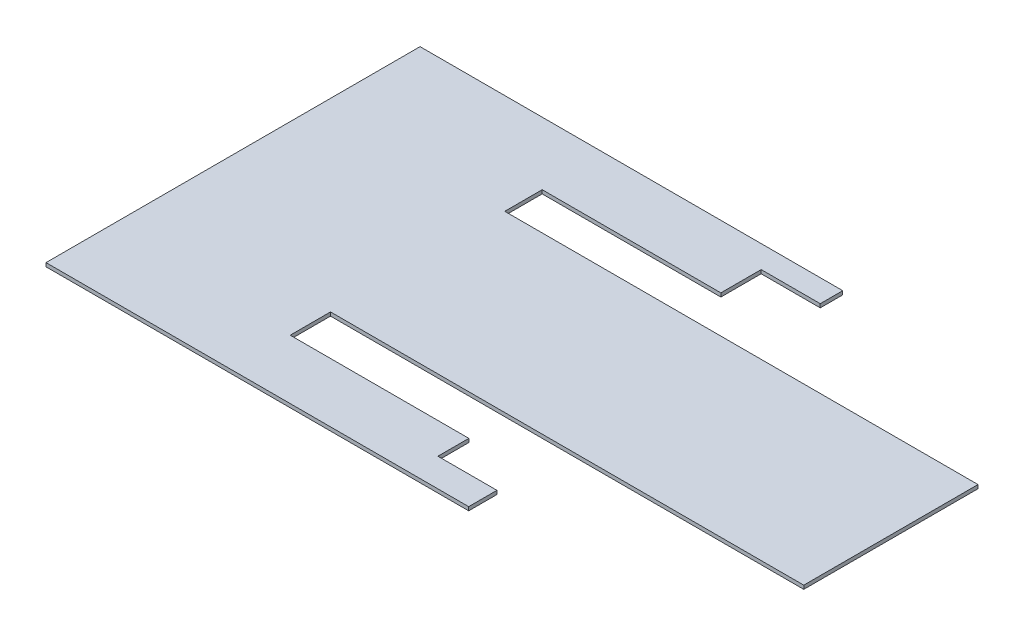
SolidWorks part; units mm, degrees
ref_plane "Front" through (0, 0, 0) normal (0, 0, 1) x (1, 0, 0)
ref_plane "Top" through (0, 0, 0) normal (0, 1, 0) x (1, 0, 0)
ref_plane "Right" through (0, 0, 0) normal (1, 0, 0) x (0, 0, -1)
sketch "Sketch1" plane through (105.9594, 0, -3.7403) normal (0, 1, 0) x (-1, 0, 0)
  line L0 (16.1231, 36.7583) -> (64.8941, 36.7583)
  line L1 (0, 52.9252) -> (115.3881, 52.9252)
  line L2 (0, 52.9252) -> (0, 45.21)
  line L3 (0, -49.1849) -> (115.3881, -49.1849)
  line L4 (115.3881, 52.9252) -> (115.3881, -49.1849)
  line L5 (64.8941, 36.7583) -> (64.8941, 25.7513)
  line L6 (64.8941, -32.0352) -> (16.1231, -32.0352)
  line L7 (16.1231, 36.7583) -> (16.1231, 45.21)
  line L8 (16.1231, 45.21) -> (0, 45.21)
  line L9 (16.1231, -32.0352) -> (16.1231, -43.0422)
  line L10 (16.1231, -43.0422) -> (0, -43.0422)
  line L11 (0, -43.0422) -> (0, -49.1849)
  line L12 (64.8941, 25.7513) -> (-9.4287, 25.7513)
  line L13 (-9.4287, 25.7513) -> (-9.4287, -21.8145)
  line L14 (-9.4287, -21.8145) -> (64.8941, -21.8145)
  line L15 (64.8941, -21.8145) -> (64.8941, -32.0352)
sheet metal parameters "Sheet-Metal2" thickness 1 parameters "D1"=2
base flange "Base-Flange2" sketch "Sketch1" thickness 1 reverse thickness direction yes parameters "D1"=2
sketch "Sketch5" plane through (0, 1, 0) normal (0, 1, 0) x (-1, 0, 0)
  line L0 (-57.7526, 22.011) -> (-57.7526, -25.5548)
  line L1 (-41.0653, 22.011) -> (-115.3881, 22.011) construction
  line L2 (-115.3881, -25.5548) -> (-41.0653, -25.5548) construction
jog "Jog5" parameters "D1"=2
bend "JogBend9" bend radius 2 bend angle 135 parameters "D5"=1
bend "JogBend10" bend radius 2 bend angle 135 parameters "D5"=2
flat pattern "Flat-Pattern2"
sketch "Bend-Lines2" plane through (0, 1, 0) normal (0, 1, 0) x (-1, 0, 0)
  line L0 (-108.1406, 22.011) -> (-108.1406, -25.5548) construction
  line L1 (-57.7526, 22.011) -> (-57.7526, -25.5548) construction
  line L2 (-108.1406, 22.011) -> (-108.1406, -25.5548) construction
  line L3 (-57.7526, 22.011) -> (-57.7526, -25.5548) construction
sketch3d "Bounding-Box1"
  line L0 (-64.293, -94.3949, 0) -> (115.3881, -94.3949, 0) construction
  line L1 (-64.293, 7.7151, 0) -> (115.3881, 7.7151, 0) construction
  line L2 (-64.293, -94.3949, 0) -> (-64.293, 7.7151, 0) construction
  line L3 (115.3881, -94.3949, 0) -> (115.3881, 7.7151, 0) construction
bend of the flat pattern "Flatten-<JogBend9>2"
bend of the flat pattern "Flatten-<JogBend10>2"
